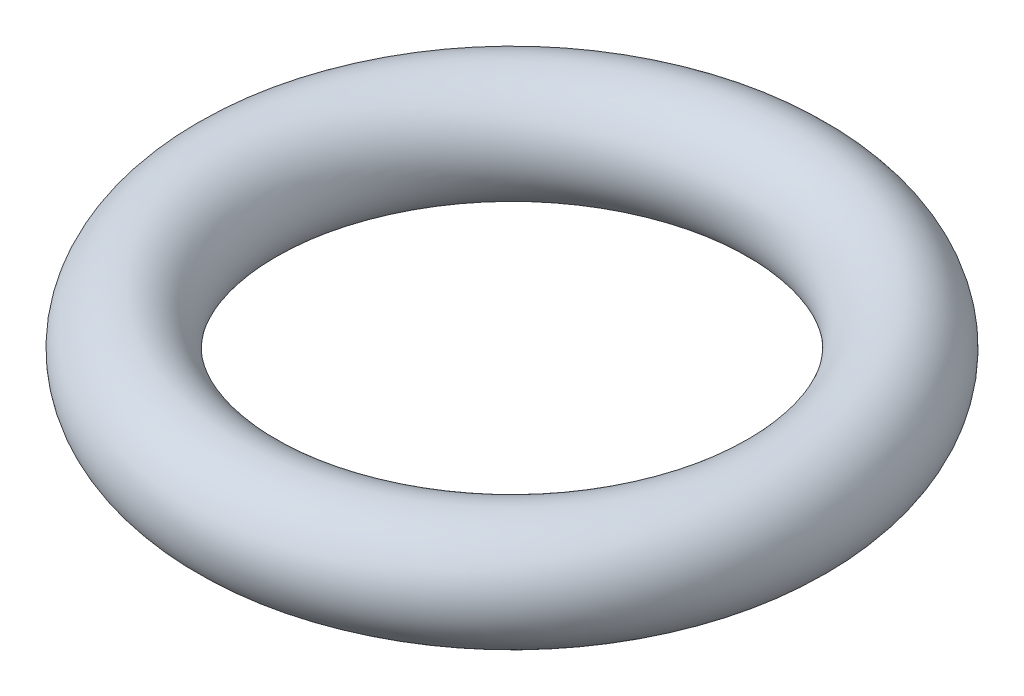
SolidWorks part; units mm, degrees
ref_plane "Vorne" through (0, 0, 0) normal (0, 0, 1) x (1, 0, 0)
ref_plane "Oben" through (0, 0, 0) normal (0, 1, 0) x (1, 0, 0)
ref_plane "Rechts" through (0, 0, 0) normal (1, 0, 0) x (0, 0, -1)
sketch "Skizze1" plane through (0, 0, 0) normal (0, 0, 1) x (1, 0, 0)
  line L0 (-2, 0.5) -> (-2, 0) construction
  line L1 (-2.5, 0) -> (0, 0) construction
  line L2 (0, 11.4902) -> (0, -4.6763) construction
  circle A0 centre (-2.5, 0.5) radius 0.5
  dimension "D2" = 1
  dimension "D1" = 2
revolve "Rotation1" add sketch "Skizze1" angle 360 about L2
